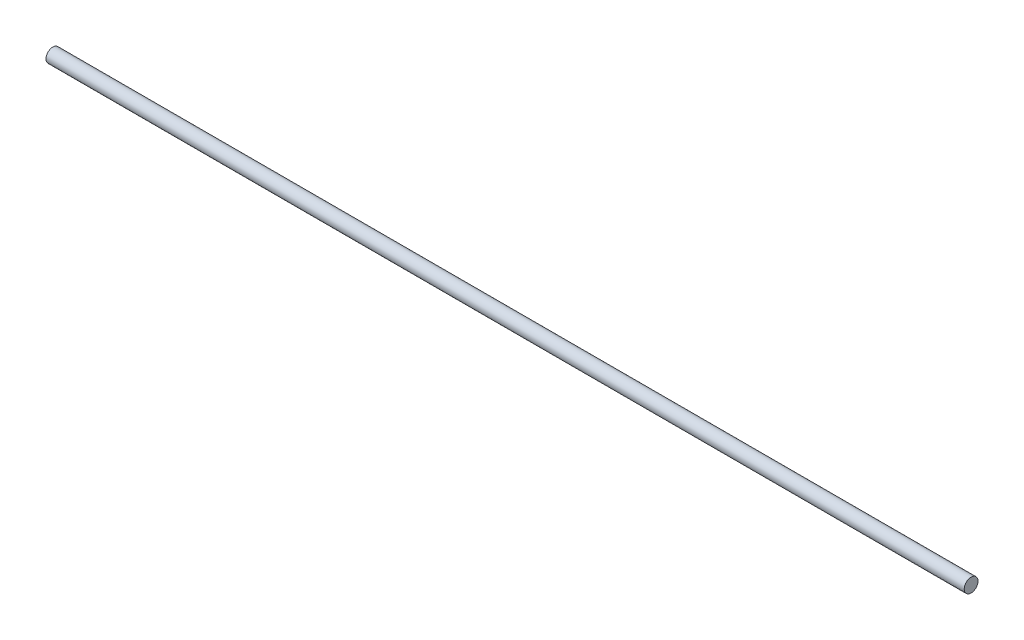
SolidWorks part; units mm, degrees
ref_plane "Front" through (0, 0, 0) normal (0, 0, 1) x (1, 0, 0)
ref_plane "Top" through (0, 0, 0) normal (0, 1, 0) x (1, 0, 0)
ref_plane "Right" through (0, 0, 0) normal (1, 0, 0) x (0, 0, -1)
sketch "Sketch1" plane through (0, 0, 0) normal (1, 0, 0) x (0, 0, -1)
  circle A0 centre (0, 0) radius 0.75
  dimension "D1" = 1.5
extrude "Boss-Extrude1" add sketch "Sketch1" along normal blind 100
